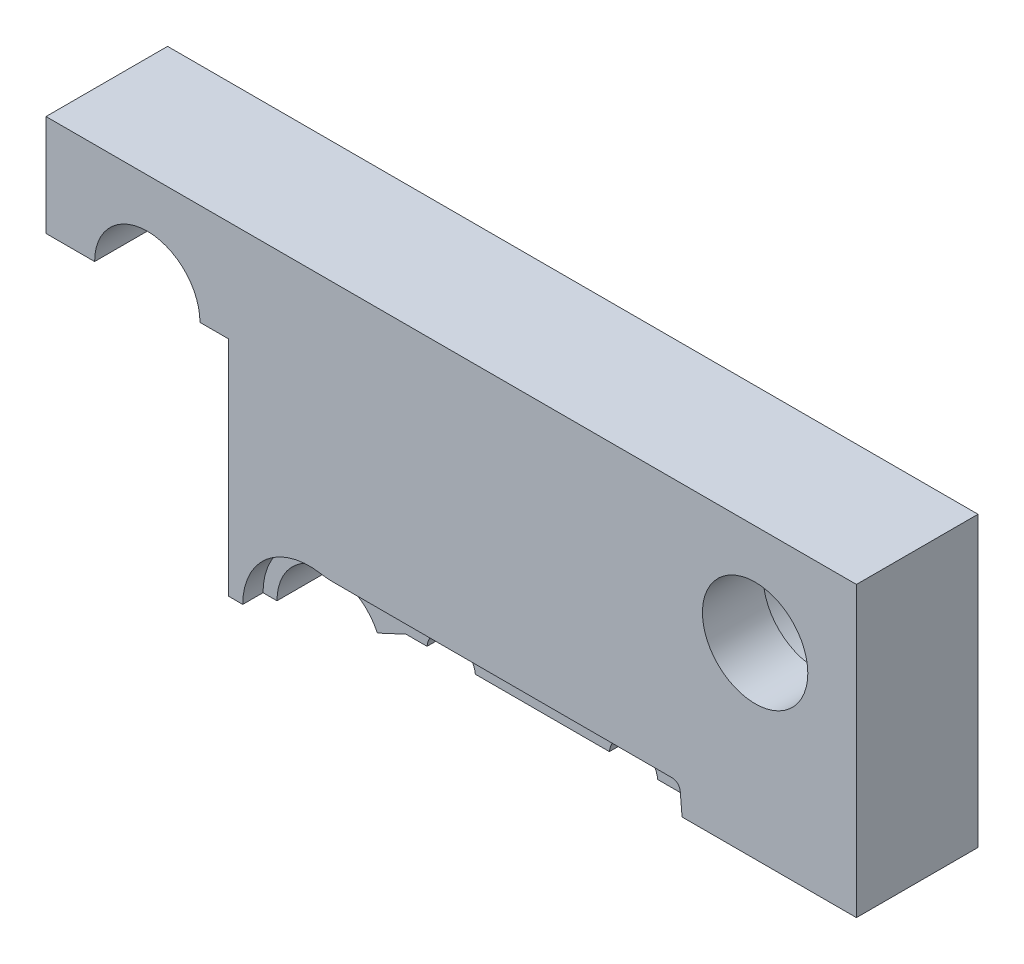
SolidWorks part; units mm, degrees
ref_plane "Plan1" through (0, 0, 0) normal (0, 0, 1) x (1, 0, 0)
ref_plane "Plan2" through (0, 0, 0) normal (0, 1, 0) x (1, 0, 0)
ref_plane "Plan3" through (0, 0, 0) normal (1, 0, 0) x (0, 0, -1)
sketch "Esquisse1" plane through (0, 0, 0) normal (0, 0, 1) x (1, 0, 0)
  line L1 (0, 0) -> (200, 0)
  line L2 (0, 0) -> (0, 150)
  line L3 (0, 150) -> (200, 150)
  line L4 (200, 0) -> (200, 150)
  dimension "D1" = 150
  dimension "D2" = 200
extrude "Base-Extrusion" add sketch "Esquisse1" along normal blind 30
sketch "Esquisse2" plane through (0, 0, 30) normal (0, 0, 1) x (1, 0, 0)
  line L0 (-10, 70) -> (90, 70) construction
  line L1 (0, 0) -> (200, 0) construction
  line L2 (20.3045, 78.12) -> (209.4484, 78.12) construction
  line L3 (71.0782, 85.935) -> (154.4898, 85.935)
  line L4 (156.5121, 84.0819) -> (157.0337, 78.12)
  line L5 (156.5121, 72.1581) -> (157.0337, 78.12)
  line L6 (95.6814, 70.305) -> (154.4898, 70.305)
  line L7 (200, 0) -> (200, 150) construction
  arc A0 (67.7404, 86.2151) -> (78.8329, 61.1069) centre (65, 70) ccw
  arc A1 (154.4898, 85.935) -> (156.5121, 84.0819) centre (154.4898, 83.905) cw
  arc A2 (71.0782, 85.935) -> (67.7404, 86.2151) centre (71.0782, 105.965) cw
  arc A3 (154.4898, 70.305) -> (156.5121, 72.1581) centre (154.4898, 72.335) ccw
  arc A4 (95.6814, 70.305) -> (78.8329, 61.1069) centre (95.6814, 50.275) ccw
  point P13 (156.35, 85.935)
  dimension "D2" = 32.89
  dimension "D6" = 91.35
  dimension "D7" = 2.03
  dimension "D8" = 20.03
  dimension "D9" = 20.03
  dimension "D10" = 135
  dimension "D1" = 70
  dimension "D3" = 8.12
  dimension "D4" = 7.815
  dimension "D5" = 95
extrude "Enlèv. mat.-Extru.1" cut sketch "Esquisse2" against normal blind 5
sketch "Esquisse3" plane through (0, 0, 25) normal (0, 0, 1) x (1, 0, 0)
  circle A0 centre (65, 70) radius 13
  dimension "D1" = 26
extrude "Enlèv. mat.-Extru.2" cut sketch "Esquisse3" against normal through all
sketch "Esquisse6" plane through (0, 0, 25) normal (0, 0, 1) x (1, 0, 0)
  line L0 (177.0279, 78.12) -> (94.3195, 78.12) construction
  line L1 (200, 0) -> (200, 150) construction
  circle A0 centre (140, 78.12) radius 6
  circle A1 centre (95, 78.12) radius 6
  dimension "D1" = 45
  dimension "D2" = 60
  dimension "D3" = 12
  dimension "D4" = 12
extrude "Enlèv. mat.-Extru.5" cut sketch "Esquisse6" against normal blind 13
sketch "Esquisse7" plane through (0, 0, 12) normal (0, 0, 1) x (1, 0, 0)
  circle A0 centre (140, 78.12) radius 9
  circle A1 centre (95, 78.12) radius 9
  dimension "D1" = 18
  dimension "D2" = 18
extrude "Enlèv. mat.-Extru.6" cut sketch "Esquisse7" against normal through all
sketch "Esquisse8" plane through (0, 0, 30) normal (0, 0, 1) x (1, 0, 0)
  line L1 (200, 0) -> (200, 150) construction
  line L2 (0, 0) -> (200, 0) construction
  circle A0 centre (25, 125) radius 13
  circle A1 centre (25, 25) radius 13
  circle A2 centre (175, 25) radius 13
  circle A3 centre (175, 125) radius 13
  dimension "D1" = 26
  dimension "D2" = 26
  dimension "D3" = 26
  dimension "D4" = 26
  dimension "D5" = 150
  dimension "D6" = 25
  dimension "D8" = 150
  dimension "D10" = 100
  dimension "D11" = 100
  dimension "D12" = 25
  dimension "D7" = 25
  dimension "D9" = 25
extrude "Enlèv. mat.-Extru.7" cut sketch "Esquisse8" against normal blind 15
sketch "Esquisse9" plane through (0, 0, 15) normal (0, 0, 1) x (1, 0, 0)
  circle A0 centre (25, 125) radius 20
  circle A1 centre (175, 125) radius 20
  circle A2 centre (175, 25) radius 20
  circle A3 centre (25, 25) radius 20
  dimension "D1" = 40
  dimension "D2" = 40
  dimension "D3" = 40
  dimension "D4" = 40
extrude "Enlèv. mat.-Extru.8" cut sketch "Esquisse9" against normal through all
sketch "Esquisse10" plane through (0, 0, 30) normal (0, 0, 1) x (1, 0, 0)
  line L0 (-8.509, 125) -> (45, 125)
  line L1 (45, 125) -> (45, 70)
  line L2 (45, 70) -> (65, 70)
  line L3 (65, 70) -> (83.8324, 78.7817)
  line L4 (83.8324, 78.7817) -> (205.0918, 78.7817)
  line L5 (0, 150) -> (0, 0) construction
  dimension "D1" = 45
  dimension "D2" = 25
extrude "Enlèv. mat.-Extru.9" cut sketch "Esquisse10" against normal through all and the other way through all flip side to cut
